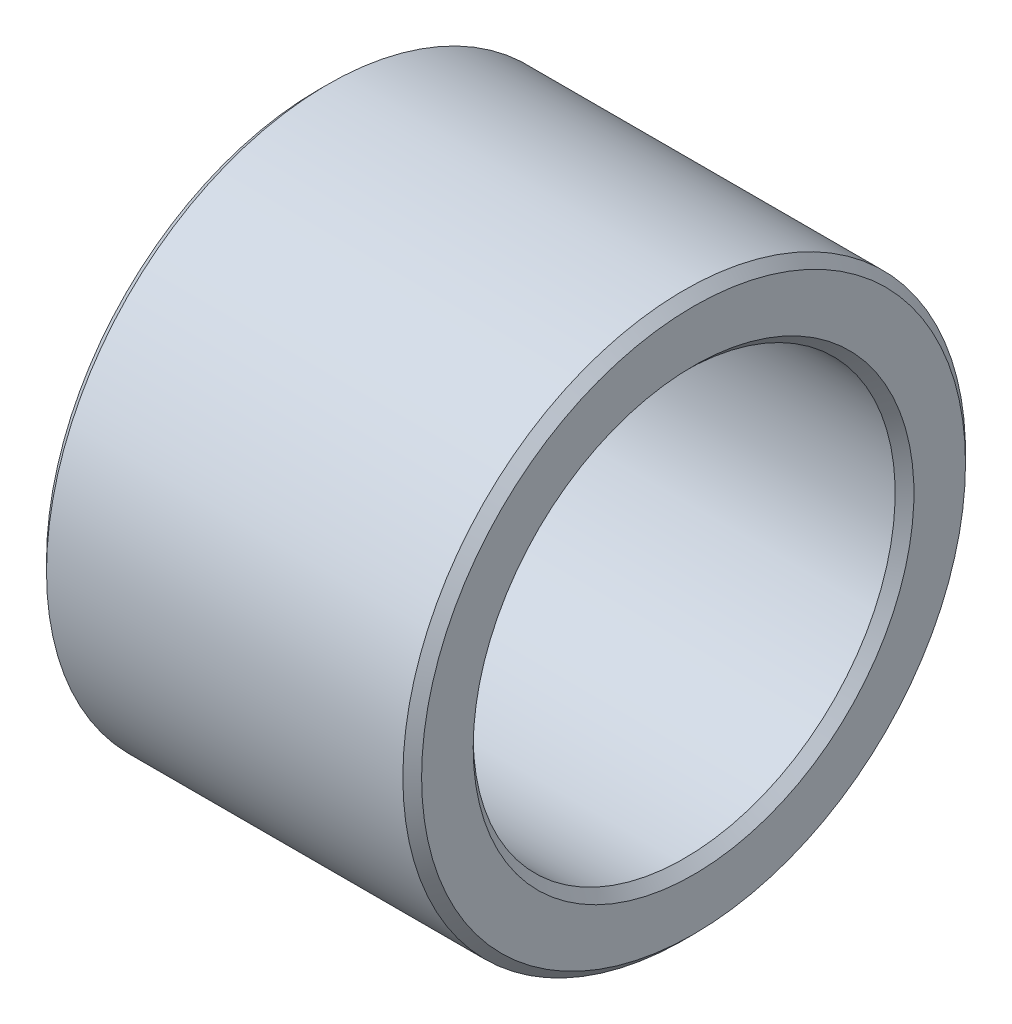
SolidWorks part; units mm, degrees
ref_plane "Plan1" through (0, 0, 0) normal (0, 0, 1) x (1, 0, 0)
ref_plane "Plan2" through (0, 0, 0) normal (0, 1, 0) x (1, 0, 0)
ref_plane "Plan3" through (0, 0, 0) normal (1, 0, 0) x (0, 0, -1)
sketch "Esquisse1" plane through (0, 0, 0) normal (0, 0, 1) x (1, 0, 0)
  line L0 (0, 9.4) -> (0, 11.6)
  line L1 (0, 11.6) -> (0.4, 12)
  line L2 (0.4, 12) -> (15.6, 12)
  line L3 (15.6, 12) -> (16, 11.6)
  line L4 (16, 11.6) -> (16, 9.4)
  line L5 (16, 9.4) -> (15.6, 9)
  line L6 (15.6, 9) -> (0.4, 9)
  line L7 (0.4, 9) -> (0, 9.4)
  line L8 (0, 0) -> (16, 0) construction
  dimension "D1" = 9
  dimension "D2" = 12
  dimension "D3" = 16
  dimension "D4" = 45
  dimension "D5" = 45
  dimension "D6" = 45
  dimension "D7" = 45
revolve "Base-Révolution" add sketch "Esquisse1" angle 360 about L8
